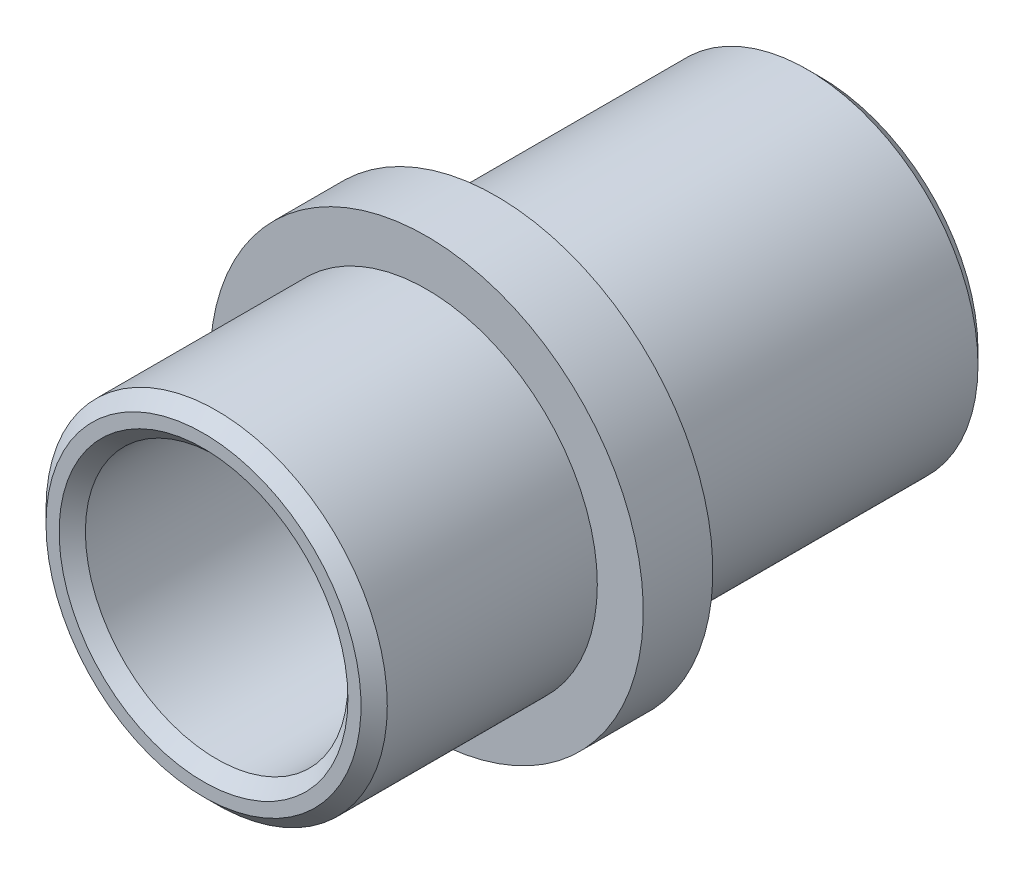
SolidWorks part; units mm, degrees
ref_plane "Plan de face" through (0, 0, 0) normal (0, 0, 1) x (1, 0, 0)
ref_plane "Plan de dessus" through (0, 0, 0) normal (0, 1, 0) x (1, 0, 0)
ref_plane "Plan de droite" through (0, 0, 0) normal (1, 0, 0) x (0, 0, -1)
sketch "Esquisse1" plane through (0, 0, 0) normal (0, 0, 1) x (1, 0, 0)
  circle A0 centre (0, 0) radius 13
  circle A1 centre (0, 0) radius 10
  dimension "D1" = 20
  dimension "D2" = 26
extrude "Extrusion1" add sketch "Esquisse1" along normal blind 47
ref_plane "Plan1" through (0, 0, 24.7) normal (0, 0, 1) x (1, 0, 0)
sketch "Esquisse2" plane through (0, 0, 24.7) normal (0, 0, 1) x (1, 0, 0)
  circle A0 centre (0, 0) radius 16.5
  circle A1 centre (0, 0) radius 10
  circle A2 centre (0, 0) radius 10 construction
  dimension "D1" = 33
extrude "Extrusion2" add sketch "Esquisse2" along normal blind 5.3
chamfer "Chanfrein1" distance 1 angle 45 4 edges at (10, 0, 47) (13, 0, 47) (10, 0, 0) (13, 0, 0)
